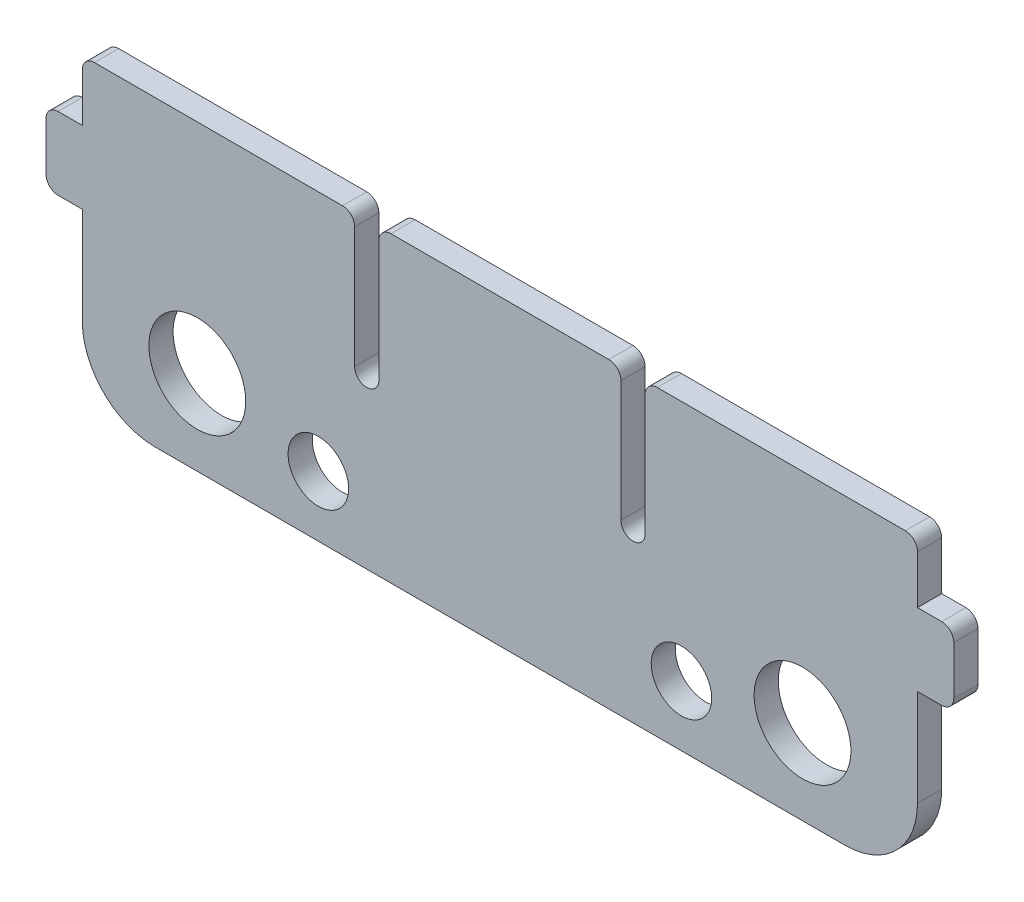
SolidWorks part; units mm, degrees
ref_plane "Plano frontal" through (0, 0, 0) normal (0, 0, 1) x (1, 0, 0)
ref_plane "Plano superior" through (0, 0, 0) normal (0, 1, 0) x (1, 0, 0)
ref_plane "Plano direito" through (0, 0, 0) normal (1, 0, 0) x (0, 0, -1)
sketch "Esboço1" plane through (0, 0, 0) normal (0, 0, 1) x (1, 0, 0)
  line L0 (-34.5, 1.5) -> (-34.5, -6.5)
  line L1 (-33.5, 12.5) -> (-13, 12.5)
  line L2 (-34.5, 11.5) -> (-34.5, 7.5)
  line L3 (-28.5, -12.5) -> (28.5, -12.5)
  line L4 (34.5, 11.5) -> (34.5, 7.5)
  line L5 (-34.5, 12.5) -> (34.5, -12.5) construction
  line L6 (-34.5, -12.5) -> (34.5, 12.5) construction
  line L7 (34.5, 7.5) -> (36.5, 7.5)
  line L8 (-11, 12.5) -> (-11, 1.5) construction
  line L9 (34.5, 1.5) -> (36.5, 1.5)
  line L10 (37.5, 6.5) -> (37.5, 2.5)
  line L11 (34.5, 4.5) -> (37.5, 1.5) construction
  line L12 (34.5, 4.5) -> (37.5, 7.5) construction
  line L13 (-34.5, 7.5) -> (-36.5, 7.5)
  line L14 (34.5, 1.5) -> (34.5, -6.5)
  line L15 (-34.5, 1.5) -> (-36.5, 1.5)
  line L16 (-37.5, 6.5) -> (-37.5, 2.5)
  line L17 (-34.5, 4.5) -> (-37.5, 1.5) construction
  line L18 (-34.5, 4.5) -> (-37.5, 7.5) construction
  line L19 (-10, 11.5) -> (-10, 1.5)
  line L20 (-12, 11.5) -> (-12, 1.5)
  line L21 (11, 12.5) -> (11, 1.5) construction
  line L22 (12, 11.5) -> (12, 1.5)
  line L23 (10, 11.5) -> (10, 1.5)
  line L24 (-9, 12.5) -> (9, 12.5)
  line L25 (13, 12.5) -> (33.5, 12.5)
  line L26 (0, 0) -> (0, -25.0208) construction
  arc A0 (28.5, -12.5) -> (34.5, -6.5) centre (28.5, -6.5) ccw
  arc A1 (-34.5, -6.5) -> (-28.5, -12.5) centre (-28.5, -6.5) ccw
  circle A2 centre (-25, -5.5) radius 4
  arc A3 (-12, 1.5) -> (-10, 1.5) centre (-11, 1.5) ccw
  circle A4 centre (-15, -7.5) radius 2.5
  arc A5 (10, 1.5) -> (12, 1.5) centre (11, 1.5) ccw
  circle A6 centre (15, -7.5) radius 2.5
  circle A7 centre (25, -5.5) radius 4
  arc A8 (-36.5, 1.5) -> (-37.5, 2.5) centre (-36.5, 2.5) cw
  arc A9 (-36.5, 7.5) -> (-37.5, 6.5) centre (-36.5, 6.5) ccw
  arc A10 (36.5, 1.5) -> (37.5, 2.5) centre (36.5, 2.5) ccw
  arc A11 (36.5, 7.5) -> (37.5, 6.5) centre (36.5, 6.5) cw
  arc A12 (33.5, 12.5) -> (34.5, 11.5) centre (33.5, 11.5) cw
  arc A13 (12, 11.5) -> (13, 12.5) centre (13, 11.5) cw
  arc A14 (10, 11.5) -> (9, 12.5) centre (9, 11.5) ccw
  arc A15 (-10, 11.5) -> (-9, 12.5) centre (-9, 11.5) cw
  arc A16 (-12, 11.5) -> (-13, 12.5) centre (-13, 11.5) ccw
  arc A17 (-33.5, 12.5) -> (-34.5, 11.5) centre (-33.5, 11.5) ccw
  point P0 (0, 0)
  point P6 (34.5, 4.5)
  point P11 (-34.5, 4.5)
  point P26 (-12, 7.5)
  point P31 (12, 7.5)
  dimension "D6" = 6
  dimension "D12" = 8
  dimension "D13" = 5
  dimension "D18" = 1
  dimension "D1" = 69
  dimension "D2" = 25
  dimension "D3" = 5
  dimension "D4" = 6
  dimension "D5" = 75
  dimension "D7" = 2
  dimension "D8" = 2
  dimension "D9" = 12
  dimension "D10" = 20
  dimension "D11" = 10
  dimension "D14" = 15
  dimension "D15" = 25
  dimension "D16" = 7
  dimension "D17" = 5
extrude "Ressalto-extrusão1" add sketch "Esboço1" along normal blind 2
